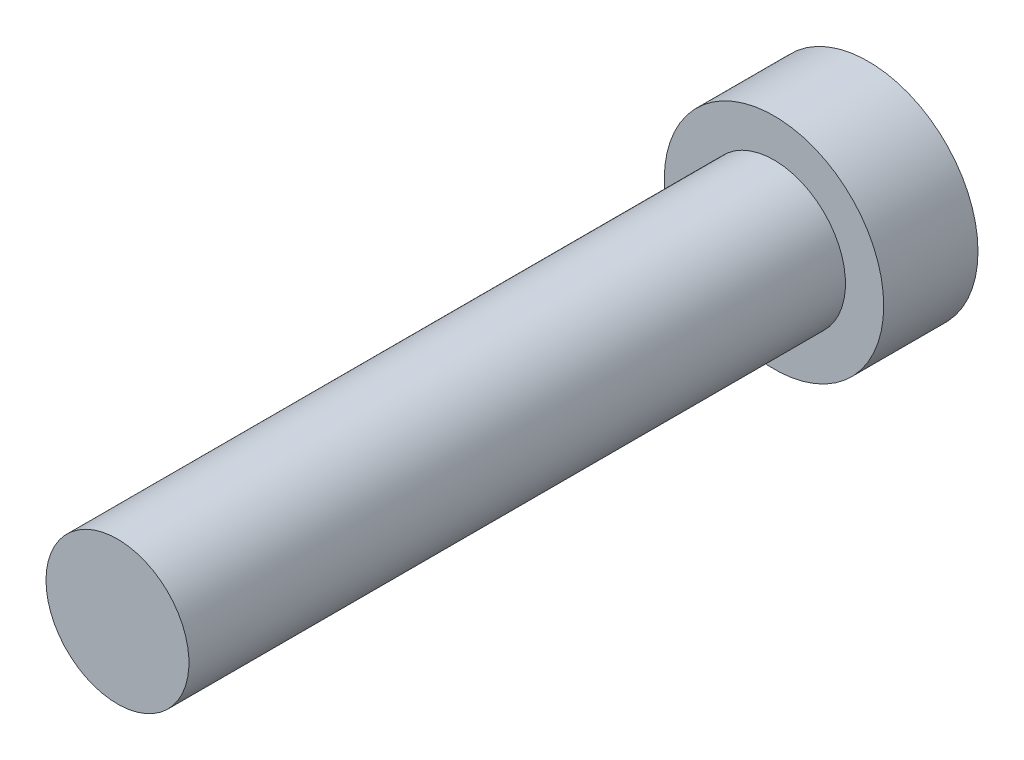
SolidWorks part; units mm, degrees
ref_plane "Front" through (0, 0, 0) normal (0, 0, 1) x (1, 0, 0)
ref_plane "Top" through (0, 0, 0) normal (0, 1, 0) x (1, 0, 0)
ref_plane "Right" through (0, 0, 0) normal (1, 0, 0) x (0, 0, -1)
sketch "Logo3_Revol_Axis" plane through (0, 0, 0) normal (0, 1, 0) x (1, 0, 0)
  line L0 (0, -43.5172) -> (0, 43.5172) construction
sketch "Logo3_bib1" plane through (0, 0, 0) normal (0, -1, 0) x (-1, 0, 0)
  line L0 (3.6195, 0) -> (5.5563, 0)
  line L1 (0, 4.7752) -> (0, -33.2499)
  line L2 (0, -43.5172) -> (0, 43.5172) construction
  line L3 (0, 4.7752) -> (5.5563, 4.7752)
  line L4 (5.5563, 0) -> (5.5563, 4.7752)
  line L7 (0, -33.2499) -> (3.6195, -33.2499)
  line L8 (3.6195, 0) -> (3.6195, -33.2499)
  line L10 (0, 16.5468) -> (0, -90.6614) construction
  dimension "logo3_head_l" = 4.7752
  dimension "logo3_l1" = 38.0251
  dimension "logo3_d1" = 7.239
  dimension "logo3_head_d" = 11.1125
revolve "Revolve1" add sketch "Logo3_bib1" angle 360 about L10
